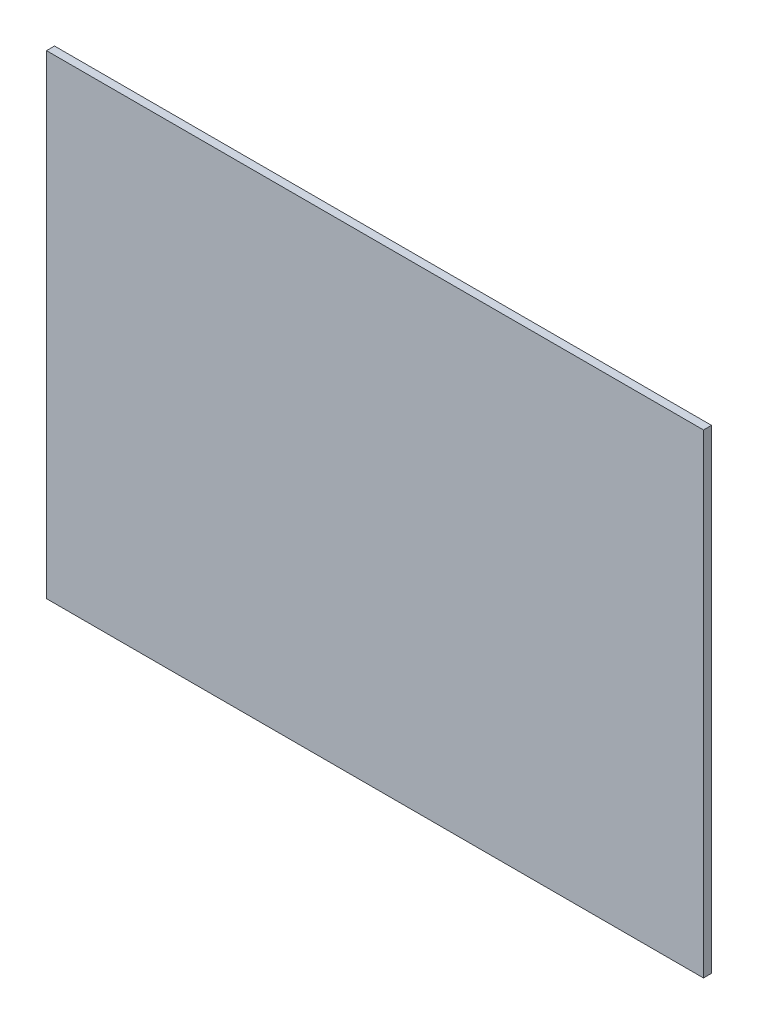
SolidWorks part; units mm, degrees
ref_plane "Front" through (0, 0, 0) normal (0, 0, 1) x (1, 0, 0)
ref_plane "Top" through (0, 0, 0) normal (0, 1, 0) x (1, 0, 0)
ref_plane "Right" through (0, 0, 0) normal (1, 0, 0) x (0, 0, -1)
sketch "Sketch1" plane through (0, 0, 0) normal (0, 0, 1) x (1, 0, 0)
  line L1 (-106.1159, 72.9438) -> (57.834, 72.9438)
  line L2 (-106.1159, 72.9438) -> (-106.1159, -45.503)
  line L3 (-106.1159, -45.503) -> (57.834, -45.503)
  line L4 (57.834, 72.9438) -> (57.834, -45.503)
extrude "Extrude1" add sketch "Sketch1" along normal blind 2
